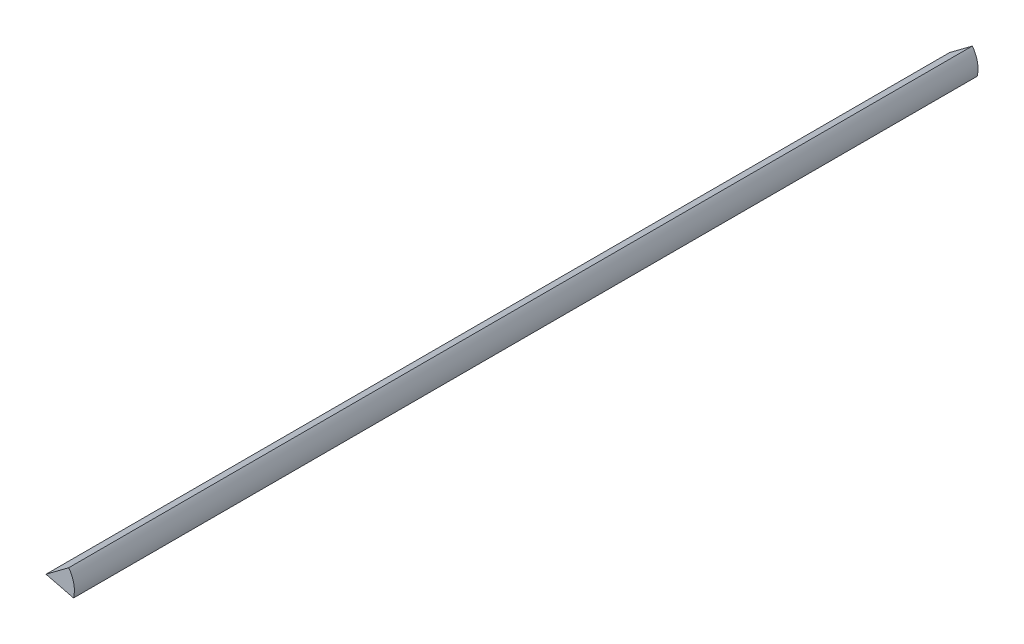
SolidWorks part; units mm, degrees
ref_plane "Front Plane" through (0, 0, 0) normal (0, 0, 1) x (1, 0, 0)
ref_plane "Top Plane" through (0, 0, 0) normal (0, 1, 0) x (1, 0, 0)
ref_plane "Right Plane" through (0, 0, 0) normal (1, 0, 0) x (0, 0, -1)
sketch "Sketch1" plane through (0, 0, 0) normal (0, 0, 1) x (1, 0, 0)
  line L0 (171.2622, -2455.7413) -> (140.7563, -2478.5666)
  line L1 (140.7563, -2478.5666) -> (177.746, -2487.6972)
  line L2 (171.2622, -2455.7413) -> (30.506, -2267.6212) construction
  arc A0 (171.2622, -2455.7413) -> (177.746, -2487.6972) centre (140.7563, -2478.5666) cw
  arc A1 (-62.0077, -2568.5427) -> (177.746, -2487.6972) centre (32.117, -2451.75) ccw construction
extrude "Boss-Extrude1" add sketch "Sketch1" against normal up to vertex (1212.85 mm away)
